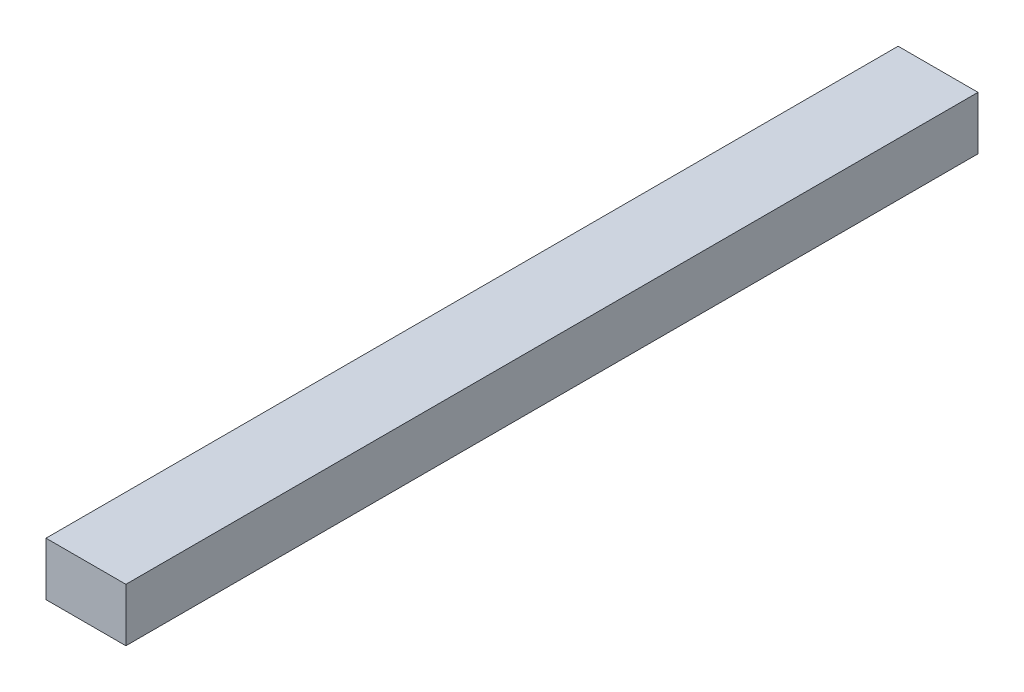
SolidWorks part; units mm, degrees
ref_plane "Front Plane" through (0, 0, 0) normal (0, 0, 1) x (1, 0, 0)
ref_plane "Top Plane" through (0, 0, 0) normal (0, 1, 0) x (1, 0, 0)
ref_plane "Right Plane" through (0, 0, 0) normal (1, 0, 0) x (0, 0, -1)
sketch "Sketch1" plane through (0, 0, 0) normal (0, 0, 1) x (1, 0, 0)
  line L1 (-3, 2) -> (3, 2)
  line L2 (-3, 2) -> (-3, -2)
  line L3 (-3, -2) -> (3, -2)
  line L4 (3, 2) -> (3, -2)
  line L5 (-3, 2) -> (3, -2) construction
  line L6 (-3, -2) -> (3, 2) construction
  point P0 (0, 0)
  dimension "D1" = 6
  dimension "D2" = 4
extrude "Boss-Extrude1" add sketch "Sketch1" along normal mid plane 64
